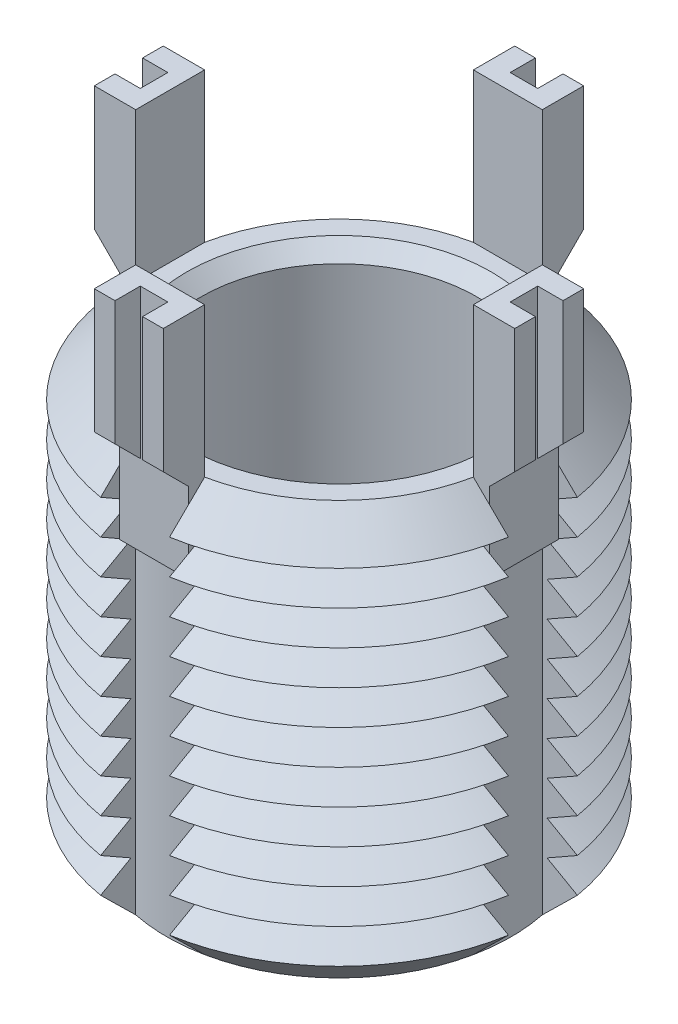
SolidWorks part; units mm, degrees
ref_plane "Front Plane" through (0, 0, 0) normal (0, 0, 1) x (1, 0, 0)
ref_plane "Top Plane" through (0, 0, 0) normal (0, 1, 0) x (1, 0, 0)
ref_plane "Right Plane" through (0, 0, 0) normal (1, 0, 0) x (0, 0, -1)
sketch "Sketch1" plane through (0, 0, 0) normal (0, 1, 0) x (1, 0, 0)
  circle A0 centre (0, 0) radius 9
  dimension "D1" = 18
extrude "Boss-Extrude1" add sketch "Sketch1" against normal blind 18
chamfer "Chamfer1" distance 1.5 angle 45 2 edges at (0, -18, 9) (0, 0, 9)
sketch "Sketch2" plane through (0, 0, 0) normal (1, 0, 0) x (0, 0, -1)
  line L0 (0, 0.8859) -> (0, -9.2617) construction
sketch "Sketch3" plane through (0, 0, 0) normal (1, 0, 0) x (0, 0, -1)
  line L0 (-9, -1.5) -> (-7.701, -2.25)
  line L1 (-7.701, -2.25) -> (-9, -3)
  line L2 (-9, -1.5) -> (-9, -16.5) construction
  line L3 (-9, -3) -> (-9, -1.5)
  dimension "D1" = 1.5
revolve "Cut-Revolve1" cut sketch "Sketch3" angle 360 about L0
pattern_linear "LPattern1" count 10 spacing 1.5 along (0, -1, 0) of "Cut-Revolve1"
sketch "Sketch4" plane through (0, 0, 0) normal (0, 1, 0) x (1, 0, 0)
  line L0 (-7.3485, 1.5) -> (-8.8741, 1.5)
  line L2 (-8.8741, -1.5) -> (-7.3485, -1.5)
  arc A0 (-7.3485, 1.5) -> (-7.3485, -1.5) centre (0, 0) ccw
  arc A1 (-8.8741, 1.5) -> (-8.8741, -1.5) centre (0, 0) ccw
  circle A2 centre (0, 0) radius 9 construction
  circle A3 centre (0, 0) radius 7.5 construction
  point P1 (-7.5, 0)
  point P3 (-9, 0)
  point P13 (0, 0)
  dimension "D1" = 3
extrude "Cut-Extrude1" cut sketch "Sketch4" against normal up to surface (18 mm away)
pattern_circular "CirPattern1" count 4 over 360 about axis through (0, 0, 0) along (0, 1, 0) of "Cut-Extrude1"
sketch "Sketch5" plane through (0, 0, 0) normal (1, 0, 0) x (0, 0, -1)
  line L0 (-7.3485, 6.5) -> (-7.3485, -3.5)
  line L1 (-7.3485, -3.5) -> (-8.0485, -3.5)
  line L2 (-8.0485, -3.5) -> (-8.0485, 0)
  line L3 (-8.0485, 0) -> (-9.1485, 1.1)
  line L4 (-9.1485, 1.1) -> (-9.1485, 6.5)
  line L5 (-9.1485, 6.5) -> (-7.3485, 6.5)
  line L6 (-8.8741, -4.5) -> (-1.5, -4.5) construction
  point P9 (-1.5, 0)
  point P10 (-8.0485, 0)
  dimension "D1" = 1
  dimension "D2" = 10
  dimension "D3" = 6.5
  dimension "D4" = 1.8
  dimension "D5" = 0.7
  dimension "D6" = 45
extrude "Boss-Extrude3" add sketch "Sketch5" along normal mid plane 3
pattern_circular "CirPattern2" count 4 over 360 about axis through (0, 0, 0) along (0, 1, 0) of "Boss-Extrude3"
sketch "Sketch6" plane through (0, 6.5, 0) normal (0, 1, 0) x (1, 0, 0)
  line L0 (-9.1485, -1.5) -> (-9.1485, 1.5) construction
  line L1 (-9.1485, -0.6) -> (-8.0485, -0.6)
  line L2 (-9.1485, -0.6) -> (-9.1485, 0.6)
  line L3 (-9.1485, 0.6) -> (-8.0485, 0.6)
  line L4 (-8.0485, -0.6) -> (-8.0485, 0.6)
  line L5 (-9.1485, -0.6) -> (-8.0485, 0.6) construction
  line L6 (-9.1485, 0.6) -> (-8.0485, -0.6) construction
  line L7 (9.1485, 1.5) -> (9.1485, -1.5) construction
  line L8 (-0.6, 8.0485) -> (0.6, 8.0485)
  line L9 (-0.6, 8.0485) -> (-0.6, 9.1485)
  line L10 (-0.6, 9.1485) -> (0.6, 9.1485)
  line L11 (0.6, 8.0485) -> (0.6, 9.1485)
  line L12 (-0.6, 8.0485) -> (0.6, 9.1485) construction
  line L13 (-0.6, 9.1485) -> (0.6, 8.0485) construction
  line L14 (8.0485, -0.6) -> (9.1485, -0.6)
  line L15 (8.0485, -0.6) -> (8.0485, 0.6)
  line L16 (8.0485, 0.6) -> (9.1485, 0.6)
  line L17 (9.1485, -0.6) -> (9.1485, 0.6)
  line L18 (8.0485, -0.6) -> (9.1485, 0.6) construction
  line L19 (8.0485, 0.6) -> (9.1485, -0.6) construction
  line L20 (-0.6, -9.1485) -> (0.6, -9.1485)
  line L21 (-0.6, -9.1485) -> (-0.6, -8.0485)
  line L22 (-0.6, -8.0485) -> (0.6, -8.0485)
  line L23 (0.6, -9.1485) -> (0.6, -8.0485)
  line L24 (-0.6, -9.1485) -> (0.6, -8.0485) construction
  line L25 (-0.6, -8.0485) -> (0.6, -9.1485) construction
  line L26 (-1.5, 9.1485) -> (1.5, 9.1485) construction
  line L27 (1.5, -9.1485) -> (-1.5, -9.1485) construction
  point P0 (-8.5985, 0)
  point P7 (-9.1485, 0)
  point P8 (-9.1485, 0)
  point P9 (0, 8.5985)
  point P14 (8.5985, 0)
  point P19 (0, -8.5985)
  point P24 (0, 9.1485)
  point P25 (9.1485, 0)
  point P26 (9.1485, 0)
  point P27 (0, 9.1485)
  point P30 (0, -9.1485)
  point P33 (0, -9.1485)
  dimension "D1" = 1.2
  dimension "D2" = 1.1
extrude "Cut-Extrude3" cut sketch "Sketch6" against normal through all both and the other way through all
sketch "Sketch7" plane through (0, 0, 0) normal (0, 1, 0) x (1, 0, 0)
  circle A0 centre (0, 0) radius 6
  dimension "D1" = 12
extrude "Cut-Extrude4" cut sketch "Sketch7" against normal up to surface (18 mm away)
chamfer "Chamfer2" distance 0.625 angle 45 2 edges at (0, 0, 6) (0, -18, 6)
